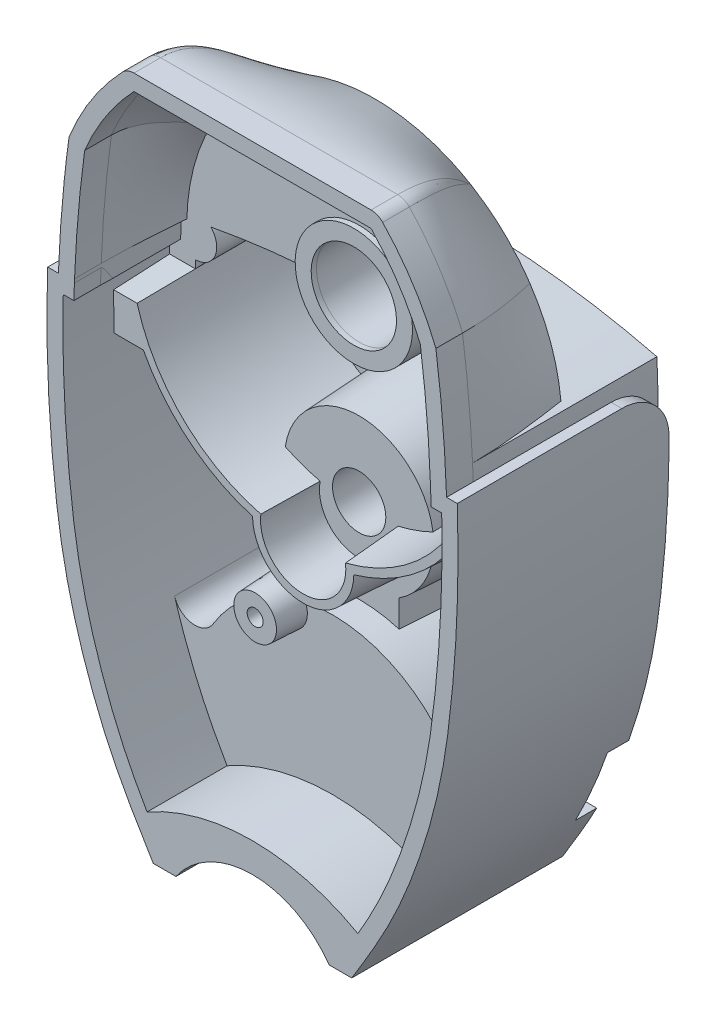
SolidWorks part; units mm, degrees
ref_plane "Plane1" through (0, 0, 0) normal (0, 0, 1) x (1, 0, 0)
ref_plane "Plane2" through (0, 0, 0) normal (0, 1, 0) x (1, 0, 0)
ref_plane "Plane3" through (0, 0, 0) normal (1, 0, 0) x (0, 0, -1)
inserted part "SW0902A<1>@SW0902A-DERIVED ASSEMBLY-"
sketch "Sketch1" plane through (0, 0, 0) normal (1, 0, 0) x (0, 0, -1)
  line L0 (72, 78.2464) -> (72, 0) construction
  line L1 (32.4405, 87.4471) -> (32.4405, 0) construction
  line L2 (-36.7, 86.9464) -> (63.3, 86.9464) construction
  line L3 (72, 78.2464) -> (72, -20)
  line L4 (32.4405, 86.9464) -> (32.4405, -20)
  line L5 (32.4405, 86.9464) -> (63.3, 86.9464)
  line L7 (32.4405, -20) -> (72, -20)
  arc A0 (72, 78.2464) -> (63.3, 86.9464) centre (63.3, 78.2464) ccw construction
  arc A1 (72, 78.2464) -> (63.3, 86.9464) centre (63.3, 78.2464) ccw
  dimension "D1" = 20
extrude "Cut-Extrude1" cut sketch "Sketch1" against normal through all and the other way through all flip side to cut
sketch "Sketch2" plane through (0, 0, -32.4405) normal (0, 0, 1) x (1, 0, 0)
  line L3 (23.4939, 126.5321) -> (-23.4939, 126.5321)
  line L4 (-36.3935, 86.9464) -> (36.3935, 86.9464)
  arc A0 (-23.4939, 126.5321) -> (-34.3902, 110.1291) centre (11.2038, 91.6624) ccw
  arc A1 (-23.4939, 126.5321) -> (-34.3902, 110.1291) centre (11.2038, 91.6624) ccw construction
  arc A4 (23.4939, 126.5321) -> (34.3902, 110.1291) centre (-11.2038, 91.6624) cw
  arc A5 (34.3902, 110.1291) -> (23.4939, 126.5321) centre (-11.2038, 91.6624) ccw construction
  spline S7 degree 3 poles (-36.3935, 86.9464) (-36.1541, 93.5898) (-35.6302, 100.217) (-34.686, 107.9168) (-34.5421, 109.0235) (-34.3902, 110.1291) knots 0.001785 0.001785 0.001785 0.001785 0.5 0.5 0.583718 0.583718 0.583718 0.583718 construction
  spline S8 degree 3 poles (34.3902, 110.1291) (34.5421, 109.0235) (34.686, 107.9168) (35.6302, 100.217) (36.1541, 93.5898) (36.3935, 86.9464) knots 0.416282 0.416282 0.416282 0.416282 0.5 0.5 0.998215 0.998215 0.998215 0.998215 construction
  spline S9 degree 3 poles (-36.3935, 86.9464) (-36.1541, 93.5898) (-35.6302, 100.217) (-34.686, 107.9168) (-34.5421, 109.0235) (-34.3902, 110.1291) knots 0.001785 0.001785 0.001785 0.001785 0.5 0.5 0.583718 0.583718 0.583718 0.583718
  spline S10 degree 3 poles (34.3902, 110.1291) (34.5421, 109.0235) (34.686, 107.9168) (35.6302, 100.217) (36.1541, 93.5898) (36.3935, 86.9464) knots 0.416282 0.416282 0.416282 0.416282 0.5 0.5 0.998215 0.998215 0.998215 0.998215
  point P5 (-29.7566, 118.9035)
  point P12 (29.6568, 119.0529)
extrude "Boss-Extrude1" add sketch "Sketch2" against normal blind 5
ref_plane "Plane4" through (0, 0, -55.4405) normal (0, 0, -1) x (-1, 0, 0)
sketch "Sketch3" plane through (0, 0, -55.4405) normal (0, 0, -1) x (-1, 0, 0)
  line L0 (0, 0) -> (0, 86.9464) construction
  line L1 (38.3948, 86.9464) -> (-38.3948, 86.9464) construction
  line L2 (35, 86.9464) -> (-35, 86.9464)
  line L3 (0, 86.9464) -> (34.3902, 110.1291) construction
  line L4 (0, 86.9464) -> (23.4939, 126.5321) construction
  line L5 (0, 86.9464) -> (-23.4939, 126.5321) construction
  line L6 (0, 86.9464) -> (-34.3902, 110.1291) construction
  arc A0 (35, 86.9464) -> (29.0217, 106.5102) centre (0, 86.9464) ccw
  arc A1 (34.3902, 110.1291) -> (23.4939, 126.5321) centre (-11.2038, 91.6624) ccw construction
  arc A2 (-29.0217, 106.5102) -> (-35, 86.9464) centre (0, 86.9464) ccw
  arc A3 (-17.8632, 117.0447) -> (-29.0217, 106.5102) centre (0, 86.9464) ccw
  arc A4 (17.8632, 117.0447) -> (-17.8632, 117.0447) centre (0, 86.9464) ccw
  arc A5 (29.0217, 106.5102) -> (17.8632, 117.0447) centre (0, 86.9464) ccw
  dimension "D1" = 35
sketch "Sketch4" plane through (0, 0, -37.4405) normal (0, 0, -1) x (-1, 0, 0)
  line L2 (23.4939, 126.5321) -> (-23.4939, 126.5321)
  line L3 (-36.3935, 86.9464) -> (36.3935, 86.9464)
  line L4 (23.4939, 126.5321) -> (-23.4939, 126.5321)
  line L5 (-36.3935, 86.9464) -> (36.3935, 86.9464)
  arc A2 (34.3902, 110.1291) -> (23.4939, 126.5321) centre (-11.2038, 91.6624) ccw
  arc A3 (-23.4939, 126.5321) -> (-34.3902, 110.1291) centre (11.2038, 91.6624) ccw
  arc A4 (34.3902, 110.1291) -> (23.4939, 126.5321) centre (-11.2038, 91.6624) ccw
  arc A5 (-23.4939, 126.5321) -> (-34.3902, 110.1291) centre (11.2038, 91.6624) ccw
  spline S2 degree 3 poles (36.3935, 86.9464) (36.1541, 93.5898) (35.6302, 100.217) (34.686, 107.9168) (34.5421, 109.0235) (34.3902, 110.1291) knots 0.001785 0.001785 0.001785 0.001785 0.5 0.5 0.583718 0.583718 0.583718 0.583718
  spline S3 degree 3 poles (-34.3902, 110.1291) (-34.5421, 109.0235) (-34.686, 107.9168) (-35.6302, 100.217) (-36.1541, 93.5898) (-36.3935, 86.9464) knots 0.416282 0.416282 0.416282 0.416282 0.5 0.5 0.998215 0.998215 0.998215 0.998215
  spline S4 degree 3 poles (36.3935, 86.9464) (36.1541, 93.5898) (35.6302, 100.217) (34.686, 107.9168) (34.5421, 109.0235) (34.3902, 110.1291) knots 0.001785 0.001785 0.001785 0.001785 0.5 0.5 0.583718 0.583718 0.583718 0.583718
  spline S5 degree 3 poles (-34.3902, 110.1291) (-34.5421, 109.0235) (-34.686, 107.9168) (-35.6302, 100.217) (-36.1541, 93.5898) (-36.3935, 86.9464) knots 0.416282 0.416282 0.416282 0.416282 0.5 0.5 0.998215 0.998215 0.998215 0.998215
  dimension "D1" = 0
loft "Boss-Loft1" add profiles "Sketch4", "Sketch3"
shell "Shell6" thickness 3
sketch "Sketch5" plane through (0, 0, -72) normal (0, 0, -1) x (-1, 0, 0)
  line L0 (36.4374, 77.9449) -> (0, 77.9449)
  line L1 (-36.4374, 77.9449) -> (0, 77.9449)
  line L2 (0, 0) -> (0, 126.5321) construction
  line L3 (-23.4939, 126.5321) -> (23.4939, 126.5321) construction
  line L7 (-35, 86.9464) -> (35, 86.9464)
  line L8 (38.3948, 86.9464) -> (-38.3948, 86.9464) construction
  line L9 (38.3948, 86.9464) -> (-38.3948, 86.9464) construction
  arc A0 (-36.2661, 89.9437) -> (-10.8058, 94.0041) centre (0, -55.6062) cw
  arc A1 (10.8058, 94.0041) -> (-10.8058, 94.0041) centre (0, 91.9464) ccw
  arc A2 (10.8058, 94.0041) -> (36.2661, 89.9437) centre (0, -55.6062) cw
  arc A3 (-36.2661, 89.9437) -> (-36.4374, 77.9449) centre (123.2135, 81.6667) ccw
  arc A4 (36.2661, 89.9437) -> (36.4374, 77.9449) centre (-123.2135, 81.6667) cw
  spline S0 degree 3 poles (-36.3935, 86.9464) (-36.1541, 93.5898) (-35.6302, 100.217) (-34.686, 107.9168) (-34.5421, 109.0235) (-34.3902, 110.1291) knots 0.416282 0.416282 0.416282 0.416282 0.914497 0.914497 0.998215 0.998215 0.998215 0.998215 construction
  spline S8 degree 3 poles (17.8632, 117.0447) (16.583, 117.8045) (15.2316, 118.4957) (12.4099, 119.7085) (10.9397, 120.2299) (7.9136, 121.0762) (6.3578, 121.401) (3.2013, 121.8361) (1.6007, 121.9464) (-1.6007, 121.9464) (-3.2013, 121.8361) (-6.3578, 121.401) (-7.9136, 121.0762) (-10.9397, 120.2299) (-12.4099, 119.7085) (-15.2316, 118.4957) (-16.583, 117.8045) (-17.8632, 117.0447) knots 0 0 0 0 0.125 0.125 0.25 0.25 0.375 0.375 0.5 0.5 0.625 0.625 0.75 0.75 0.875 0.875 1 1 1 1
  spline S9 degree 3 poles (-17.8632, 117.0447) (-20.0626, 115.7394) (-22.1442, 114.1739) (-25.9096, 110.6191) (-27.5921, 108.6309) (-29.0217, 106.5102) knots 0 0 0 0 0.5 0.5 1 1 1 1
  spline S10 degree 3 poles (-29.0217, 106.5102) (-29.5701, 105.6967) (-30.0875, 104.855) (-30.9266, 103.3498) (-31.2641, 102.6976) (-32.3283, 100.4698) (-32.9628, 98.8415) (-33.9814, 95.5081) (-34.3655, 93.8033) (-34.8748, 90.3747) (-35, 88.6512) (-35, 86.9464) knots 0 0 0 0 0.143862 0.143862 0.25 0.25 0.5 0.5 0.75 0.75 1 1 1 1
  spline S11 degree 3 poles (35, 86.9464) (35, 88.6512) (34.8748, 90.3747) (34.3655, 93.8033) (33.9814, 95.5081) (32.9628, 98.8415) (32.3283, 100.4698) (31.2641, 102.6976) (30.9266, 103.3498) (30.0875, 104.855) (29.5701, 105.6967) (29.0217, 106.5102) knots 0 0 0 0 0.25 0.25 0.5 0.5 0.75 0.75 0.856138 0.856138 1 1 1 1
  spline S12 degree 3 poles (29.0217, 106.5102) (27.5921, 108.6309) (25.9096, 110.6191) (22.1442, 114.1739) (20.0626, 115.7394) (17.8632, 117.0447) knots 0 0 0 0 0.5 0.5 1 1 1 1
  spline S13 degree 3 poles (17.8632, 117.0447) (16.583, 117.8045) (15.2316, 118.4957) (12.4099, 119.7085) (10.9397, 120.2299) (7.9136, 121.0762) (6.3578, 121.401) (3.2013, 121.8361) (1.6007, 121.9464) (-1.6007, 121.9464) (-3.2013, 121.8361) (-6.3578, 121.401) (-7.9136, 121.0762) (-10.9397, 120.2299) (-12.4099, 119.7085) (-15.2316, 118.4957) (-16.583, 117.8045) (-17.8632, 117.0447) knots 0 0 0 0 0.125 0.125 0.25 0.25 0.375 0.375 0.5 0.5 0.625 0.625 0.75 0.75 0.875 0.875 1 1 1 1 construction
  spline S14 degree 3 poles (-17.8632, 117.0447) (-20.0626, 115.7394) (-22.1442, 114.1739) (-25.9096, 110.6191) (-27.5921, 108.6309) (-29.0217, 106.5102) knots 0 0 0 0 0.5 0.5 1 1 1 1 construction
  spline S15 degree 3 poles (-29.0217, 106.5102) (-29.5701, 105.6967) (-30.0875, 104.855) (-30.9266, 103.3498) (-31.2641, 102.6976) (-32.3283, 100.4698) (-32.9628, 98.8415) (-33.9814, 95.5081) (-34.3655, 93.8033) (-34.8748, 90.3747) (-35, 88.6512) (-35, 86.9464) knots 0 0 0 0 0.143862 0.143862 0.25 0.25 0.5 0.5 0.75 0.75 1 1 1 1 construction
  spline S16 degree 3 poles (35, 86.9464) (35, 88.6512) (34.8748, 90.3747) (34.3655, 93.8033) (33.9814, 95.5081) (32.9628, 98.8415) (32.3283, 100.4698) (31.2641, 102.6976) (30.9266, 103.3498) (30.0875, 104.855) (29.5701, 105.6967) (29.0217, 106.5102) knots 0 0 0 0 0.25 0.25 0.5 0.5 0.75 0.75 0.856138 0.856138 1 1 1 1 construction
  spline S17 degree 3 poles (29.0217, 106.5102) (27.5921, 108.6309) (25.9096, 110.6191) (22.1442, 114.1739) (20.0626, 115.7394) (17.8632, 117.0447) knots 0 0 0 0 0.5 0.5 1 1 1 1 construction
  point P27 (-36.3935, 86.9464)
  point P28 (-36.2661, 89.9437)
  point P29 (36.3935, 86.9464)
  dimension "D4" = 150
  dimension "D5" = 11
  dimension "D1" = 12
  dimension "D2" = 3
  dimension "D6" = 5
  dimension "D3" = 0
extrude "Boss-Extrude2" add sketch "Sketch5" against normal up to next
ref_plane "Plane5" through (0, 0, -69) normal (0, 0, -1) x (-1, 0, 0)
sketch "Sketch8" plane through (0, 0, -69) normal (0, 0, -1) x (-1, 0, 0)
  line L0 (-33.3492, 75.2464) -> (33.3492, 75.2464)
  line L6 (35.5203, 75.2464) -> (33.3492, 75.2464)
  line L7 (-33.3492, 75.2464) -> (-35.5203, 75.2464)
  line L8 (-16.9225, 3) -> (16.9225, 3)
  line L9 (35.5203, 75.2464) -> (33.3492, 75.2464) construction
  line L10 (-33.3492, 75.2464) -> (-35.5203, 75.2464) construction
  line L11 (-16.9225, 3) -> (16.9225, 3) construction
  arc A10 (33.3492, 75.2464) -> (33.3701, 87.5561) centre (-123.2135, 81.6667) ccw
  arc A11 (33.3701, 87.5561) -> (7.963, 91.178) centre (0, -55.6062) ccw
  arc A12 (7.963, 91.178) -> (-7.963, 91.178) centre (0, 91.9464) ccw
  arc A13 (-7.963, 91.178) -> (-33.3701, 87.5561) centre (0, -55.6062) ccw
  arc A14 (-33.3701, 87.5561) -> (-33.3492, 75.2464) centre (123.2135, 81.6667) ccw
  arc A15 (33.3492, 75.2464) -> (33.3701, 87.5561) centre (-123.2135, 81.6667) ccw
  arc A16 (33.3701, 87.5561) -> (7.963, 91.178) centre (0, -55.6062) ccw
  arc A17 (7.963, 91.178) -> (-7.963, 91.178) centre (0, 91.9464) ccw
  arc A18 (-7.963, 91.178) -> (-33.3701, 87.5561) centre (0, -55.6062) ccw
  arc A19 (-33.3701, 87.5561) -> (-33.3492, 75.2464) centre (123.2135, 81.6667) ccw
  spline S4 degree 3 poles (-35.5203, 75.2464) (-35.4293, 68.9195) (-35.0793, 62.6107) (-34.3182, 54.7473) (-34.1498, 53.1758) (-33.7806, 50.035) (-33.585, 48.4643) (-32.8894, 43.7774) (-32.2975, 40.6799) (-31.2107, 36.0756) (-30.8153, 34.5478) (-29.9601, 31.5058) (-29.4997, 29.9902) (-28.0341, 25.4891) (-26.9481, 22.5385) (-25.1268, 18.2011) (-24.487, 16.7704) (-23.1345, 13.9424) (-22.4195, 12.5463) (-20.1762, 8.4032) (-18.5581, 5.6976) (-16.9225, 3) knots 0 0 0 0 0.25 0.25 0.3125 0.3125 0.375 0.375 0.5 0.5 0.5625 0.5625 0.625 0.625 0.75 0.75 0.8125 0.8125 0.875 0.875 1 1 1 1
  spline S5 degree 3 poles (16.9225, 3) (18.5623, 5.7045) (20.1853, 8.4179) (22.4396, 12.5846) (23.1589, 13.9906) (24.5208, 16.8438) (25.1665, 18.2913) (27.0008, 22.6733) (28.088, 25.6407) (29.5491, 30.1493) (30.0063, 31.6622) (30.8582, 34.7094) (31.2534, 36.2457) (32.3351, 40.8622) (32.9204, 43.955) (33.4909, 47.8391) (33.5955, 48.6169) (33.7935, 50.1739) (33.8889, 50.9528) (34.1624, 53.2909) (34.3289, 54.8514) (35.0817, 62.6628) (35.4296, 68.9403) (35.5203, 75.2464) knots 0 0 0 0 0.125 0.125 0.1875 0.1875 0.25 0.25 0.375 0.375 0.4375 0.4375 0.5 0.5 0.625 0.625 0.65625 0.65625 0.6875 0.6875 0.75 0.75 1 1 1 1
  spline S6 degree 3 poles (-35.5203, 75.2464) (-35.4293, 68.9195) (-35.0793, 62.6107) (-34.3182, 54.7473) (-34.1498, 53.1758) (-33.7806, 50.035) (-33.585, 48.4643) (-32.8894, 43.7774) (-32.2975, 40.6799) (-31.2107, 36.0756) (-30.8153, 34.5478) (-29.9601, 31.5058) (-29.4997, 29.9902) (-28.0341, 25.4891) (-26.9481, 22.5385) (-25.1268, 18.2011) (-24.487, 16.7704) (-23.1345, 13.9424) (-22.4195, 12.5463) (-20.1762, 8.4032) (-18.5581, 5.6976) (-16.9225, 3) knots 0 0 0 0 0.25 0.25 0.3125 0.3125 0.375 0.375 0.5 0.5 0.5625 0.5625 0.625 0.625 0.75 0.75 0.8125 0.8125 0.875 0.875 1 1 1 1 construction
  spline S7 degree 3 poles (16.9225, 3) (18.5623, 5.7045) (20.1853, 8.4179) (22.4396, 12.5846) (23.1589, 13.9906) (24.5208, 16.8438) (25.1665, 18.2913) (27.0008, 22.6733) (28.088, 25.6407) (29.5491, 30.1493) (30.0063, 31.6622) (30.8582, 34.7094) (31.2534, 36.2457) (32.3351, 40.8622) (32.9204, 43.955) (33.4909, 47.8391) (33.5955, 48.6169) (33.7935, 50.1739) (33.8889, 50.9528) (34.1624, 53.2909) (34.3289, 54.8514) (35.0817, 62.6628) (35.4296, 68.9403) (35.5203, 75.2464) knots 0 0 0 0 0.125 0.125 0.1875 0.1875 0.25 0.25 0.375 0.375 0.4375 0.4375 0.5 0.5 0.625 0.625 0.65625 0.65625 0.6875 0.6875 0.75 0.75 1 1 1 1 construction
  dimension "D1" = 3
extrude "Cut-Extrude2" cut sketch "Sketch8" against normal through all
fillet "Fillet1" radius 3
sketch "Sketch9" plane through (0, 0, -69) normal (0, 0, 1) x (1, 0, 0)
  line L3 (35.544, 78.2464) -> (33.4434, 78.2464)
  line L4 (-33.4434, 78.2464) -> (-35.544, 78.2464)
  line L5 (-16.9225, 3) -> (16.9225, 3)
  line L8 (-16.9225, 3) -> (16.9225, 3)
  arc A0 (25.8159, 19.8428) -> (-25.8159, 19.8428) centre (0, 16.0975) ccw
  arc A5 (33.4434, 78.2464) -> (33.3701, 87.5561) centre (-123.2135, 81.6667) ccw
  arc A6 (33.3701, 87.5561) -> (7.963, 91.178) centre (0, -55.6062) ccw
  arc A7 (7.963, 91.178) -> (-7.963, 91.178) centre (0, 91.9464) ccw
  arc A8 (-7.963, 91.178) -> (-33.3701, 87.5561) centre (0, -55.6062) ccw
  arc A9 (-33.3701, 87.5561) -> (-33.4434, 78.2464) centre (123.2135, 81.6667) ccw
  spline S2 degree 3 poles (-35.544, 78.2464) (-35.5347, 71.6773) (-35.2462, 65.1411) (-34.4013, 55.3857) (-34.052, 52.1419) (-33.2114, 45.6711) (-32.6508, 42.4523) (-31.5949, 37.6495) (-31.2059, 36.0529) (-30.3555, 32.8684) (-29.893, 31.2775) (-28.9052, 28.1292) (-28.3797, 26.5694) (-27.2679, 23.4775) (-26.6809, 21.9457) (-25.4369, 18.914) (-24.7799, 17.414) (-23.3873, 14.4499) (-22.6495, 12.9866) (-20.3228, 8.6485) (-18.6323, 5.8199) (-16.9225, 3) knots 0 0 0 0 0.25 0.25 0.375 0.375 0.5 0.5 0.5625 0.5625 0.625 0.625 0.6875 0.6875 0.75 0.75 0.8125 0.8125 0.875 0.875 1 1 1 1
  spline S3 degree 3 poles (16.9225, 3) (18.6292, 5.8148) (20.3162, 8.6377) (22.6352, 12.9592) (23.3701, 14.4153) (24.7563, 17.362) (25.4099, 18.8516) (26.6469, 21.8597) (27.2303, 23.3782) (28.3351, 26.4406) (28.8572, 27.9843) (30.3297, 32.6541) (31.1856, 35.8189) (32.2583, 40.6531) (32.5806, 42.274) (33.1508, 45.517) (33.4004, 47.1417) (33.8273, 50.3977) (34.0202, 52.0276) (34.3742, 55.2901) (34.5338, 56.923) (35.2445, 65.0952) (35.5347, 71.6581) (35.544, 78.2464) knots 0 0 0 0 0.125 0.125 0.1875 0.1875 0.25 0.25 0.3125 0.3125 0.375 0.375 0.5 0.5 0.5625 0.5625 0.625 0.625 0.6875 0.6875 0.75 0.75 1 1 1 1
  spline S4 degree 3 poles (-35.544, 78.2464) (-35.5347, 71.6773) (-35.2462, 65.1411) (-34.4013, 55.3857) (-34.052, 52.1419) (-33.2114, 45.6711) (-32.6508, 42.4523) (-31.5949, 37.6495) (-31.2059, 36.0529) (-30.3555, 32.8684) (-29.893, 31.2775) (-28.9052, 28.1292) (-28.3797, 26.5694) (-27.2679, 23.4775) (-26.6809, 21.9457) (-25.4369, 18.914) (-24.7799, 17.414) (-23.3873, 14.4499) (-22.6495, 12.9866) (-20.3228, 8.6485) (-18.6323, 5.8199) (-16.9225, 3) knots 0 0 0 0 0.25 0.25 0.375 0.375 0.5 0.5 0.5625 0.5625 0.625 0.625 0.6875 0.6875 0.75 0.75 0.8125 0.8125 0.875 0.875 1 1 1 1 only from (-25.8159, 19.8428) to (-16.9225, 3)
  spline S5 degree 3 poles (16.9225, 3) (18.6292, 5.8148) (20.3162, 8.6377) (22.6352, 12.9592) (23.3701, 14.4153) (24.7563, 17.362) (25.4099, 18.8516) (26.6469, 21.8597) (27.2303, 23.3782) (28.3351, 26.4406) (28.8572, 27.9843) (30.3297, 32.6541) (31.1856, 35.8189) (32.2583, 40.6531) (32.5806, 42.274) (33.1508, 45.517) (33.4004, 47.1417) (33.8273, 50.3977) (34.0202, 52.0276) (34.3742, 55.2901) (34.5338, 56.923) (35.2445, 65.0952) (35.5347, 71.6581) (35.544, 78.2464) knots 0 0 0 0 0.125 0.125 0.1875 0.1875 0.25 0.25 0.3125 0.3125 0.375 0.375 0.5 0.5 0.5625 0.5625 0.625 0.625 0.6875 0.6875 0.75 0.75 1 1 1 1 only from (16.9225, 3) to (25.8159, 19.8428)
  dimension "D1" = 0
extrude "Boss-Extrude3" add sketch "Sketch9" along normal offset from surface (21.5595 mm away) 15
sketch "Sketch11" plane through (0, 0, -47.4405) normal (0, 0, 1) x (1, 0, 0)
  line L2 (17.4856, 2) -> (-17.4856, 2)
  line L3 (17.4856, 2) -> (-17.4856, 2)
  arc A0 (20.6301, 7.2695) -> (-20.63, 7.2696) centre (0, -27) ccw
  spline S5 degree 3 poles (-17.4856, 2) (-18.4073, 3.5202) (-19.3304, 5.0464) (-21.1321, 8.1237) (-22.0119, 9.6751) (-23.6907, 12.82) (-24.4855, 14.415) (-25.9777, 17.641) (-26.6768, 19.2715) (-27.9942, 22.5638) (-28.6122, 24.2254) (-29.7771, 27.576) (-30.3241, 29.2664) (-31.3428, 32.6789) (-31.8144, 34.4011) (-32.6775, 37.8791) (-33.0689, 39.6394) (-33.7658, 43.166) (-34.0711, 44.9326) (-34.4661, 47.5871) (-34.5854, 48.474) (-34.8098, 50.2403) (-34.9167, 51.1222) (-35.4258, 55.5389) (-35.7515, 59.0771) (-36.4841, 69.7131) (-36.6474, 76.8287) (-36.4816, 83.9696) knots 0 0 0 0 0.0625 0.0625 0.125 0.125 0.1875 0.1875 0.25 0.25 0.3125 0.3125 0.375 0.375 0.4375 0.4375 0.5 0.5 0.5625 0.5625 0.59375 0.59375 0.625 0.625 0.75 0.75 1 1 1 1
  spline S6 degree 3 poles (36.4816, 83.9696) (36.647, 76.8459) (36.4845, 69.7671) (35.7626, 59.2143) (35.4419, 55.7081) (34.9423, 51.338) (34.8372, 50.4648) (34.6174, 48.7196) (34.5017, 47.8433) (34.1182, 45.2208) (33.8216, 43.4782) (32.8079, 38.2667) (31.9657, 34.8147) (30.4518, 29.6736) (29.906, 27.9658) (29.0275, 25.4131) (28.7247, 24.5637) (28.0976, 22.8665) (27.7734, 22.0193) (26.771, 19.4952) (26.0621, 17.832) (24.5509, 14.5489) (23.747, 12.9294) (22.0508, 9.7442) (21.1626, 8.1764) (19.3451, 5.0705) (18.4146, 3.5322) (17.4856, 2) knots 0 0 0 0 0.25 0.25 0.375 0.375 0.40625 0.40625 0.4375 0.4375 0.5 0.5 0.625 0.625 0.6875 0.6875 0.71875 0.71875 0.75 0.75 0.8125 0.8125 0.875 0.875 0.9375 0.9375 1 1 1 1
  spline S7 degree 3 poles (-17.4856, 2) (-18.4073, 3.5202) (-19.3304, 5.0464) (-21.1321, 8.1237) (-22.0119, 9.6751) (-23.6907, 12.82) (-24.4855, 14.415) (-25.9777, 17.641) (-26.6768, 19.2715) (-27.9942, 22.5638) (-28.6122, 24.2254) (-29.7771, 27.576) (-30.3241, 29.2664) (-31.3428, 32.6789) (-31.8144, 34.4011) (-32.6775, 37.8791) (-33.0689, 39.6394) (-33.7658, 43.166) (-34.0711, 44.9326) (-34.4661, 47.5871) (-34.5854, 48.474) (-34.8098, 50.2403) (-34.9167, 51.1222) (-35.4258, 55.5389) (-35.7515, 59.0771) (-36.4841, 69.7131) (-36.6474, 76.8287) (-36.4816, 83.9696) knots 0 0 0 0 0.0625 0.0625 0.125 0.125 0.1875 0.1875 0.25 0.25 0.3125 0.3125 0.375 0.375 0.4375 0.4375 0.5 0.5 0.5625 0.5625 0.59375 0.59375 0.625 0.625 0.75 0.75 1 1 1 1 only from (-17.4856, 2) to (-20.63, 7.2696)
  spline S8 degree 3 poles (36.4816, 83.9696) (36.647, 76.8459) (36.4845, 69.7671) (35.7626, 59.2143) (35.4419, 55.7081) (34.9423, 51.338) (34.8372, 50.4648) (34.6174, 48.7196) (34.5017, 47.8433) (34.1182, 45.2208) (33.8216, 43.4782) (32.8079, 38.2667) (31.9657, 34.8147) (30.4518, 29.6736) (29.906, 27.9658) (29.0275, 25.4131) (28.7247, 24.5637) (28.0976, 22.8665) (27.7734, 22.0193) (26.771, 19.4952) (26.0621, 17.832) (24.5509, 14.5489) (23.747, 12.9294) (22.0508, 9.7442) (21.1626, 8.1764) (19.3451, 5.0705) (18.4146, 3.5322) (17.4856, 2) knots 0 0 0 0 0.25 0.25 0.375 0.375 0.40625 0.40625 0.4375 0.4375 0.5 0.5 0.625 0.625 0.6875 0.6875 0.71875 0.71875 0.75 0.75 0.8125 0.8125 0.875 0.875 0.9375 0.9375 1 1 1 1 only from (20.6301, 7.2695) to (17.4856, 2)
  dimension "D2" = 40
  dimension "D3" = 29
  dimension "D1" = 1
extrude "Boss-Extrude5" add sketch "Sketch11" along normal up to surface (15 mm away)
sketch "Sketch12" plane through (0, 0, -32.4405) normal (0, 0, 1) x (1, 0, 0)
  circle A0 centre (0, -10) radius 17.5
  dimension "D1" = 35
  dimension "D2" = 10
extrude "Cut-Extrude3" cut sketch "Sketch12" against normal through all
sketch "Sketch14" plane through (0, 0, -52.4405) normal (0, 0, 1) x (1, 0, 0)
  line L0 (0, 58) -> (0, 0) construction
  line L1 (7.5, 46.1784) -> (7.5, 41.0822)
  line L2 (-7.5, 46.1784) -> (-7.5, 41.0822)
  arc A0 (7.5, 46.1784) -> (-7.5, 46.1784) centre (0, 58) ccw
  arc A1 (25.8159, 19.8428) -> (-25.8159, 19.8428) centre (0, 16.0975) ccw construction
  arc A2 (7.5, 41.0822) -> (-7.5, 41.0822) centre (0, 16.0975) ccw
  dimension "D1" = 28
  dimension "D2" = 58
  dimension "D3" = 15
extrude "Boss-Extrude6" add sketch "Sketch14" against normal up to next draft 3
ref_plane "Plane6" through (0, 0, -41.9405) normal (0, 0, 1) x (1, 0, 0)
sketch "Sketch15" plane through (0, 0, -41.9405) normal (0, 0, 1) x (1, 0, 0)
  line L0 (35.4759, 72.9464) -> (29.9615, 72.9464)
  line L1 (-63.3491, 87.7992) -> (52.1494, 87.7992) construction
  line L2 (-35.5402, 79.9464) -> (-31.1307, 79.9464)
  line L3 (0, 0) -> (0, 88.6348) construction
  line L4 (35.5402, 79.9464) -> (31.1307, 79.9464)
  line L6 (-35.4759, 72.9464) -> (-29.9615, 72.9464)
  arc A0 (-31.1307, 79.9464) -> (-7.9385, 57.3046) centre (0, 88.6348) ccw
  arc A1 (-7.9385, 57.3046) -> (7.9385, 57.3046) centre (0, 56.3145) ccw
  arc A2 (29.9615, 72.9464) -> (9.499, 56.1758) centre (0, 88.6348) cw
  circle A3 centre (-9, 40) radius 4 construction
  arc A4 (31.1307, 79.9464) -> (7.9385, 57.3046) centre (0, 88.6348) cw
  arc A5 (-9.499, 56.1758) -> (9.499, 56.1758) centre (0, 56.3145) ccw
  arc A6 (-29.9615, 72.9464) -> (-9.499, 56.1758) centre (0, 88.6348) ccw
  spline S0 degree 3 poles (-19.7668, 7.7746) (-20.5919, 9.1982) (-21.395, 10.6308) (-22.9261, 13.5269) (-23.6512, 14.9916) (-25.7047, 19.4358) (-26.9175, 22.4629) (-29.099, 28.6175) (-30.0689, 31.7446) (-31.3218, 36.5182) (-31.7056, 38.1233) (-32.4023, 41.3627) (-32.7142, 42.9859) (-33.1267, 45.4245) (-33.2556, 46.238) (-33.495, 47.8665) (-33.604, 48.6815) (-33.9141, 51.128) (-34.1038, 52.7603) (-34.6198, 57.6614) (-34.8937, 60.9342) (-35.506, 70.7687) (-35.6351, 77.3466) (-35.4819, 83.9464) knots 0 0 0 0 0.0625 0.0625 0.125 0.125 0.25 0.25 0.375 0.375 0.4375 0.4375 0.5 0.5 0.53125 0.53125 0.5625 0.5625 0.625 0.625 0.75 0.75 1 1 1 1 construction
  spline S1 degree 3 poles (-19.7668, 7.7746) (-20.5919, 9.1982) (-21.395, 10.6308) (-22.9261, 13.5269) (-23.6512, 14.9916) (-25.7047, 19.4358) (-26.9175, 22.4629) (-29.099, 28.6175) (-30.0689, 31.7446) (-31.3218, 36.5182) (-31.7056, 38.1233) (-32.4023, 41.3627) (-32.7142, 42.9859) (-33.1267, 45.4245) (-33.2556, 46.238) (-33.495, 47.8665) (-33.604, 48.6815) (-33.9141, 51.128) (-34.1038, 52.7603) (-34.6198, 57.6614) (-34.8937, 60.9342) (-35.506, 70.7687) (-35.6351, 77.3466) (-35.4819, 83.9464) knots 0 0 0 0 0.0625 0.0625 0.125 0.125 0.25 0.25 0.375 0.375 0.4375 0.4375 0.5 0.5 0.53125 0.53125 0.5625 0.5625 0.625 0.625 0.75 0.75 1 1 1 1 only from (-35.4759, 72.9464) to (-35.5402, 79.9464)
  spline S2 degree 3 poles (19.7668, 7.7746) (20.5919, 9.1982) (21.395, 10.6308) (22.9261, 13.5269) (23.6512, 14.9916) (25.7047, 19.4358) (26.9175, 22.4629) (29.099, 28.6175) (30.0689, 31.7446) (31.3218, 36.5182) (31.7056, 38.1233) (32.4023, 41.3627) (32.7142, 42.9859) (33.1267, 45.4245) (33.2556, 46.238) (33.495, 47.8665) (33.604, 48.6815) (33.9141, 51.128) (34.1038, 52.7603) (34.6198, 57.6614) (34.8937, 60.9342) (35.506, 70.7687) (35.6351, 77.3466) (35.4819, 83.9464) knots 0 0 0 0 0.0625 0.0625 0.125 0.125 0.25 0.25 0.375 0.375 0.4375 0.4375 0.5 0.5 0.53125 0.53125 0.5625 0.5625 0.625 0.625 0.75 0.75 1 1 1 1 only from (35.4759, 72.9464) to (35.5402, 79.9464)
  point P2 (32.3096, 87.7992)
  point P4 (-17.2526, 115.9653)
  dimension "D1" = 16
  dimension "D4" = 8
  dimension "D2" = 40
  dimension "D3" = 9
  dimension "D5" = 7
  dimension "D7" = 7
  dimension "D6" = 1.5
sketch "Sketch16" plane through (0, 0, -52.4405) normal (0, 0, 1) x (1, 0, 0)
  circle A0 centre (0, 58) radius 5
  arc A1 (7.5, 46.1784) -> (-7.5, 46.1784) centre (0, 58) ccw construction
  dimension "D1" = 10
extrude "Cut-Extrude5" cut sketch "Sketch16" against normal through all
extrude "Boss-Extrude7" add sketch "Sketch15" against normal up to next draft 3
sketch "Sketch17" plane through (0, 0, -41.9405) normal (0, 0, 1) x (1, 0, 0)
  circle A3 centre (-9, 40) radius 4
  point P2 (32.3096, 87.7992)
  point P3 (-66.8325, 111.7532)
  dimension "D1" = 8
  dimension "D2" = 40
  dimension "D3" = 9
extrude "Boss-Extrude8" add sketch "Sketch17" against normal up to next draft 3
sketch "Sketch18" plane through (0, 0, 0) normal (0, 1, 0) x (-1, 0, 0)
  line L0 (101.7205, -52.4405) -> (-98.1393, -52.4405)
draft "Draft2" type of draft neutral plane draft angle 3 faces to draft 3 parameters "D1"=3
sketch "Sketch19" plane through (0, 0, -41.9405) normal (0, 0, 1) x (1, 0, 0)
  circle A0 centre (-9, 40) radius 1.5
  circle A1 centre (-9, 40) radius 4 construction
  dimension "D1" = 3
extrude "Cut-Extrude6" cut sketch "Sketch19" against normal blind 8
sketch "Sketch20" plane through (0, 0, -52.4405) normal (0, 0, 1) x (1, 0, 0)
  line L0 (-30.7101, 81.9967) -> (-30.7101, 80.4967)
  line L1 (0, 91.9464) -> (0, 123.5321) construction
  line L2 (22.2327, 123.5321) -> (-22.2327, 123.5321) construction
  line L3 (-35.4819, 83.9464) -> (-33.4996, 83.9464) construction
  line L4 (-30.7101, 80.4967) -> (-35.5363, 80.4967)
  line L5 (-35.4819, 83.9464) -> (-33.4996, 83.9464)
  line L6 (-33.4996, 83.9464) -> (-33.3684, 87.5565)
  line L7 (33.4996, 83.9464) -> (33.3684, 87.5565)
  line L8 (35.4819, 83.9464) -> (33.4996, 83.9464)
  line L9 (30.7101, 80.4967) -> (35.5363, 80.4967)
  line L10 (30.7101, 81.9967) -> (30.7101, 80.4967)
  arc A0 (-30.7101, 81.9967) -> (-27.8001, 88.7412) centre (-30.7101, 85.9967) ccw
  arc A1 (-7.963, 91.178) -> (-32.3096, 87.7992) centre (0, -55.6062) ccw construction
  arc A2 (-27.8001, 88.7412) -> (-32.3096, 87.7992) centre (0, -55.6062) ccw
  arc A3 (-32.3096, 87.7992) -> (-33.3684, 87.5565) centre (0, -55.6062) ccw construction
  arc A4 (-32.3096, 87.7992) -> (-33.3684, 87.5565) centre (0, -55.6062) ccw
  arc A5 (32.3096, 87.7992) -> (33.3684, 87.5565) centre (0, -55.6062) cw
  arc A6 (27.8001, 88.7412) -> (32.3096, 87.7992) centre (0, -55.6062) cw
  arc A7 (30.7101, 81.9967) -> (27.8001, 88.7412) centre (30.7101, 85.9967) cw
  spline S1 degree 3 poles (-19.7668, 7.7746) (-20.5919, 9.1982) (-21.395, 10.6308) (-22.9261, 13.5269) (-23.6512, 14.9916) (-25.7047, 19.4358) (-26.9175, 22.4629) (-29.099, 28.6175) (-30.0689, 31.7446) (-31.3218, 36.5182) (-31.7056, 38.1233) (-32.4023, 41.3627) (-32.7142, 42.9859) (-33.1267, 45.4245) (-33.2556, 46.238) (-33.495, 47.8665) (-33.604, 48.6815) (-33.9141, 51.128) (-34.1038, 52.7603) (-34.6198, 57.6614) (-34.8937, 60.9342) (-35.506, 70.7687) (-35.6351, 77.3466) (-35.4819, 83.9464) knots 0 0 0 0 0.0625 0.0625 0.125 0.125 0.25 0.25 0.375 0.375 0.4375 0.4375 0.5 0.5 0.53125 0.53125 0.5625 0.5625 0.625 0.625 0.75 0.75 1 1 1 1 construction
  spline S2 degree 3 poles (-19.7668, 7.7746) (-20.5919, 9.1982) (-21.395, 10.6308) (-22.9261, 13.5269) (-23.6512, 14.9916) (-25.7047, 19.4358) (-26.9175, 22.4629) (-29.099, 28.6175) (-30.0689, 31.7446) (-31.3218, 36.5182) (-31.7056, 38.1233) (-32.4023, 41.3627) (-32.7142, 42.9859) (-33.1267, 45.4245) (-33.2556, 46.238) (-33.495, 47.8665) (-33.604, 48.6815) (-33.9141, 51.128) (-34.1038, 52.7603) (-34.6198, 57.6614) (-34.8937, 60.9342) (-35.506, 70.7687) (-35.6351, 77.3466) (-35.4819, 83.9464) knots 0 0 0 0 0.0625 0.0625 0.125 0.125 0.25 0.25 0.375 0.375 0.4375 0.4375 0.5 0.5 0.53125 0.53125 0.5625 0.5625 0.625 0.625 0.75 0.75 1 1 1 1 only from (-35.5363, 80.4967) to (-35.4819, 83.9464)
  spline S4 degree 3 poles (19.7668, 7.7746) (20.5919, 9.1981) (21.395, 10.6308) (22.9261, 13.5269) (23.6512, 14.9916) (25.7047, 19.4358) (26.9175, 22.4629) (29.099, 28.6175) (30.0689, 31.7446) (31.3218, 36.5182) (31.7056, 38.1233) (32.4023, 41.3627) (32.7142, 42.9859) (33.1267, 45.4245) (33.2556, 46.238) (33.495, 47.8665) (33.604, 48.6815) (33.9141, 51.128) (34.1038, 52.7603) (34.6198, 57.6614) (34.8937, 60.9342) (35.506, 70.7687) (35.6351, 77.3466) (35.4819, 83.9464) knots 0 0 0 0 0.0625 0.0625 0.125 0.125 0.25 0.25 0.375 0.375 0.4375 0.4375 0.5 0.5 0.53125 0.53125 0.5625 0.5625 0.625 0.625 0.75 0.75 1 1 1 1 only from (35.5363, 80.4967) to (35.4819, 83.9464)
  point P17 (-27.8001, 88.7412)
  point P20 (-33.8853, 87.9653)
  point P24 (-30.7101, 81.9967)
  point P26 (-30.7101, 85.9967)
  point P29 (-30.7101, 80.4967)
  point P34 (33.8853, 87.9653)
extrude "Boss-Extrude9" add sketch "Sketch20" against normal up to next
sketch "Sketch22" plane through (0, 0, -69) normal (0, 0, 1) x (1, 0, 0)
  circle A0 centre (0, 91.9464) radius 11
  arc A1 (6.9536, 90.3605) -> (-6.9536, 90.3605) centre (0, 91.9464) ccw construction
  circle A2 centre (0, 91.9464) radius 8
  dimension "D1" = 22
  dimension "D2" = 3
extrude "Boss-Extrude10" add sketch "Sketch22" along normal offset from surface (17.5595 mm away) 1
sketch "Sketch23" plane through (0, 0, -52.4405) normal (0, 0, 1) x (1, 0, 0)
  circle A3 centre (0, 91.9464) radius 8.01
  circle A4 centre (0, 91.9464) radius 8.01
  dimension "D1" = 0.01
extrude "Cut-Extrude8" cut sketch "Sketch23" against normal up to surface (16.5595 mm away)
sketch "Sketch24" plane through (0, 0, -69) normal (0, 0, 1) x (1, 0, 0)
  circle A0 centre (0, 91.9464) radius 4.5
  circle A1 centre (0, 91.9464) radius 8 construction
  dimension "D1" = 9
extrude "Cut-Extrude9" cut sketch "Sketch24" against normal through all
sketch "Sketch25" plane through (0, 0, -72) normal (0, 0, -1) x (-1, 0, 0)
  line L0 (18.0055, 25) -> (27.8153, 25)
  line L1 (0, 0) -> (0, 39.6411) construction
  line L2 (-21.582, 11) -> (21.582, 11)
  line L3 (-18.0055, 25) -> (-27.8153, 25)
  arc A1 (14.3614, 0) -> (-14.3614, 0) centre (0, -10) ccw construction
  arc A2 (-6.4432, 35.1222) -> (-19.8781, 18.9813) centre (0, 16.0975) ccw
  arc A3 (18.0055, 25) -> (-18.0055, 25) centre (0, 16.0975) ccw
  spline S1 degree 3 poles (25.8159, 19.8428) (25.371, 18.7772) (24.9156, 17.7364) (24.2165, 16.212) (23.982, 15.7126) (23.5015, 14.7132) (23.0079, 13.7106) (22.3583, 12.4495) (21.937, 11.6575) (21.7833, 11.3719) (21.749, 11.3084) (21.7309, 11.2749) (21.6851, 11.19) (21.5928, 11.0196) (20.9975, 9.9274) (20.3718, 8.8186) (19.7668, 7.7746) knots 0 0 0 0 0.25 0.25 0.375 0.375 0.5 0.625 0.6875 0.695313 0.695313 0.703125 0.703125 0.71875 0.75 1 1 1 1 construction
  spline S2 degree 3 poles (-35.4313, 71.3449) (-35.3628, 69.1534) (-35.2132, 65.8687) (-34.9935, 62.588) (-34.8315, 60.4017) (-34.7429, 59.312) (-34.4518, 56.0199) (-34.1719, 53.2959) (-33.8453, 50.5961) (-33.711, 49.5182) (-33.6427, 48.9811) (-33.424, 47.3507) (-33.2625, 46.2669) (-32.7308, 43.0251) (-32.3128, 40.8722) (-31.3548, 36.6122) (-30.6716, 33.9474) (-29.804, 31.0129) (-29.5579, 30.2123) (-29.3917, 29.6785) (-29.3092, 29.4171) (-28.8917, 28.1084) (-28.4546, 26.8015) (-27.9932, 25.4969) (-27.8067, 24.9752) (-27.7111, 24.7106) (-27.4236, 23.9237) (-27.0353, 22.8848) (-26.5381, 21.6118) (-26.2344, 20.8595) (-26.0308, 20.3605) (-25.9231, 20.0996) (-25.8159, 19.8428) knots 0 0 0 0 0.125 0.1875 0.1875 0.25 0.25 0.375 0.40625 0.40625 0.4375 0.4375 0.5 0.5 0.625 0.625 0.75 0.78125 0.796875 0.796875 0.8125 0.8125 0.875 0.890625 0.890625 0.90625 0.90625 0.9375 0.96875 0.984375 0.984375 1 1 1 1 only from (-27.8153, 25) to (-25.8159, 19.8428)
  spline S3 degree 3 poles (25.8159, 19.8428) (25.371, 18.7772) (24.9156, 17.7364) (24.2165, 16.212) (23.982, 15.7126) (23.5015, 14.7132) (23.0079, 13.7106) (22.3583, 12.4495) (21.937, 11.6575) (21.7833, 11.3719) (21.749, 11.3084) (21.7309, 11.2749) (21.6851, 11.19) (21.5928, 11.0196) (20.9975, 9.9274) (20.3718, 8.8186) (19.7668, 7.7746) knots 0 0 0 0 0.25 0.25 0.375 0.375 0.5 0.625 0.6875 0.695313 0.695313 0.703125 0.703125 0.71875 0.75 1 1 1 1 only from (25.8159, 19.8428) to (21.582, 11)
  spline S4 degree 3 poles (35.4369, 71.5283) (35.3699, 69.329) (35.2223, 66.0328) (35.0041, 62.7405) (34.8429, 60.5465) (34.7548, 59.4539) (34.4645, 56.1494) (34.185, 53.4152) (33.8586, 50.7053) (33.7243, 49.6233) (33.6561, 49.0854) (33.4381, 47.449) (33.277, 46.3613) (32.7461, 43.1076) (32.3281, 40.9464) (31.3696, 36.6717) (30.6855, 33.9976) (29.816, 31.0529) (29.5694, 30.2495) (29.4028, 29.7139) (29.3199, 29.4509) (28.9013, 28.1376) (28.4631, 26.8261) (28.0003, 25.5169) (27.8133, 24.9934) (27.7175, 24.7281) (27.4289, 23.9383) (27.0395, 22.8955) (26.5406, 21.6179) (26.2359, 20.863) (26.0315, 20.3622) (25.9235, 20.1005) (25.8159, 19.8428) knots 0 0 0 0 0.125 0.1875 0.1875 0.25 0.25 0.375 0.40625 0.40625 0.4375 0.4375 0.5 0.5 0.625 0.625 0.75 0.78125 0.796875 0.796875 0.8125 0.8125 0.875 0.890625 0.890625 0.90625 0.90625 0.9375 0.96875 0.984375 0.984375 1 1 1 1 construction
  spline S5 degree 3 poles (35.4369, 71.5283) (35.3699, 69.329) (35.2223, 66.0328) (35.0041, 62.7405) (34.8429, 60.5465) (34.7548, 59.4539) (34.4645, 56.1494) (34.185, 53.4152) (33.8586, 50.7053) (33.7243, 49.6233) (33.6561, 49.0854) (33.4381, 47.449) (33.277, 46.3613) (32.7461, 43.1076) (32.3281, 40.9464) (31.3696, 36.6717) (30.6855, 33.9976) (29.816, 31.0529) (29.5694, 30.2495) (29.4028, 29.7139) (29.3199, 29.4509) (28.9013, 28.1376) (28.4631, 26.8261) (28.0003, 25.5169) (27.8133, 24.9934) (27.7175, 24.7281) (27.4289, 23.9383) (27.0395, 22.8955) (26.5406, 21.6179) (26.2359, 20.863) (26.0315, 20.3622) (25.9235, 20.1005) (25.8159, 19.8428) knots 0 0 0 0 0.125 0.1875 0.1875 0.25 0.25 0.375 0.40625 0.40625 0.4375 0.4375 0.5 0.5 0.625 0.625 0.75 0.78125 0.796875 0.796875 0.8125 0.8125 0.875 0.890625 0.890625 0.90625 0.90625 0.9375 0.96875 0.984375 0.984375 1 1 1 1 only from (27.8153, 25) to (25.8159, 19.8428)
  spline S6 degree 3 poles (-25.8159, 19.8428) (-25.371, 18.7772) (-24.9156, 17.7364) (-24.2165, 16.212) (-23.982, 15.7126) (-23.5015, 14.7132) (-23.0079, 13.7106) (-22.3583, 12.4495) (-21.937, 11.6575) (-21.7833, 11.3719) (-21.749, 11.3084) (-21.7309, 11.2749) (-21.6851, 11.19) (-21.5928, 11.0196) (-20.9975, 9.9274) (-20.3718, 8.8186) (-19.7668, 7.7746) knots 0 0 0 0 0.25 0.25 0.375 0.375 0.5 0.625 0.6875 0.695313 0.695313 0.703125 0.703125 0.71875 0.75 1 1 1 1 only from (-25.8159, 19.8428) to (-21.582, 11)
  dimension "D3" = 21
  dimension "D2" = 25
  dimension "D1" = 6
fillet "Fillet4" radius 4
extrude "Cut-Extrude12" cut sketch "Sketch25" against normal offset from surface (21.5595 mm away) 3
fillet "Fillet5" radius 3
sketch "Sketch26" plane through (0, 0, -72) normal (0, 0, -1) x (-1, 0, 0)
  arc A0 (-6.968, 91.2783) -> (6.968, 91.2783) centre (0, 58) ccw
  circle A1 centre (0, 58) radius 5 construction
  arc A3 (6.8764, 93.2559) -> (-6.8764, 93.2559) centre (0, 91.9464) ccw
  arc A4 (6.968, 91.2783) -> (-6.968, 91.2783) centre (0, 91.9464) ccw
  dimension "D2" = 34
  dimension "D1" = 4
extrude "Cut-Extrude13" cut sketch "Sketch26" against normal blind 1
sketch "Sketch27" plane through (0, 0, 0) normal (1, 0, 0) x (0, 0, -1)
  line L0 (50.4405, 11) -> (72, 11) construction
  line L1 (68, 11) -> (72, 11)
  line L3 (72, 25) -> (68, 25)
  line L4 (72, 11) -> (72, 25)
  line L6 (68, 25) -> (68, 11)
  line L7 (72, 25) -> (50.4405, 25) construction
  dimension "D1" = 4
extrude "Cut-Extrude14" cut sketch "Sketch27" against normal through all and the other way through all
chamfer "Chamfer3" distance 4 angle 45
